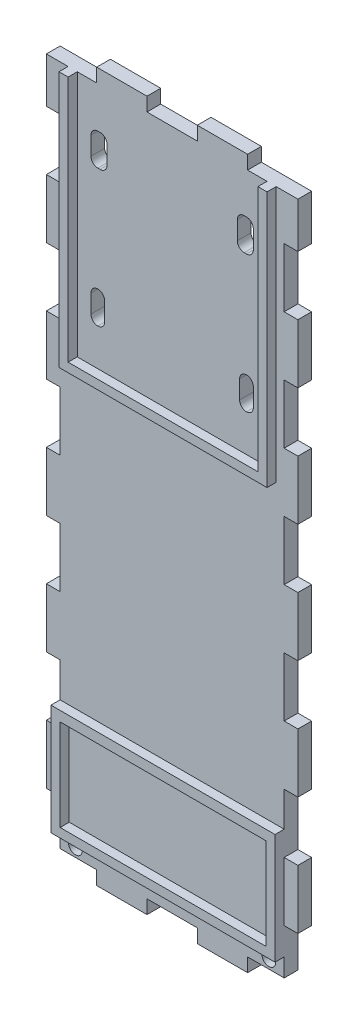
SolidWorks part; units mm, degrees
ref_plane "Front Plane" through (0, 0, 0) normal (0, 0, 1) x (1, 0, 0)
ref_plane "Top Plane" through (0, 0, 0) normal (0, 1, 0) x (1, 0, 0)
ref_plane "Right Plane" through (0, 0, 0) normal (1, 0, 0) x (0, 0, -1)
sketch "Sketch1" plane through (0, 0, 0) normal (0, 0, 1) x (1, 0, 0)
  line L1 (-27.5, 77.5) -> (27.5, 77.5)
  line L2 (-27.5, 77.5) -> (-27.5, -77.5)
  line L3 (-27.5, -77.5) -> (27.5, -77.5)
  line L4 (27.5, 77.5) -> (27.5, -77.5)
  line L5 (-27.5, 77.5) -> (27.5, -77.5) construction
  line L6 (-27.5, -77.5) -> (27.5, 77.5) construction
  point P0 (0, 0)
extrude "Boss-Extrude1" add sketch "Sketch1" along normal blind 3
sketch "Sketch2" plane through (0, 0, 3) normal (0, 0, 1) x (1, 0, 0)
  line L0 (-27.5, 77.5) -> (-27.5, 64.5833)
  line L1 (-27.5, 77.5) -> (-27.5, -77.5) construction
  line L2 (-27.5, 64.5833) -> (-24.5, 64.5833)
  line L3 (-24.5, 64.5833) -> (-24.5, 51.6667)
  line L4 (-24.5, 51.6667) -> (-27.5, 51.6667)
  line L5 (-27.5, 51.6667) -> (-27.5, 38.75)
  line L6 (-27.5, 38.75) -> (-24.5, 38.75)
  line L7 (-24.5, 38.75) -> (-24.5, 25.8333)
  line L8 (-24.5, 25.8333) -> (-27.5, 25.8333)
  line L9 (-27.5, 25.8333) -> (-27.5, 12.9167)
  line L10 (-27.5, 12.9167) -> (-24.5, 12.9167)
  line L11 (-24.5, 12.9167) -> (-24.5, 0)
  line L12 (-24.5, 0) -> (-27.5, 0)
  line L13 (-27.5, 0) -> (-27.5, -12.9167)
  line L14 (-27.5, -12.9167) -> (-24.5, -12.9167)
  line L15 (-24.5, -12.9167) -> (-24.5, -25.8333)
  line L16 (-24.5, -25.8333) -> (-27.5, -25.8333)
  line L17 (-27.5, -25.8333) -> (-27.5, -38.75)
  line L18 (-27.5, -38.75) -> (-24.5, -38.75)
  line L19 (-24.5, -38.75) -> (-24.5, -51.6667)
  line L20 (-24.5, -51.6667) -> (-27.5, -51.6667)
  line L21 (-27.5, -51.6667) -> (-27.5, -64.5833)
  line L22 (-27.5, -64.5833) -> (-24.5, -64.5833)
  line L23 (-24.5, -64.5833) -> (-24.5, -77.5)
  line L24 (-27.5, -77.5) -> (27.5, -77.5) construction
  line L25 (-27.5, 64.5833) -> (-27.5, -64.5833)
  line L26 (0, 77.5) -> (0, -77.5) construction
  line L27 (27.5, 77.5) -> (-27.5, 77.5) construction
  line L28 (24.5, -64.5833) -> (24.5, -77.5)
  line L29 (27.5, -64.5833) -> (24.5, -64.5833)
  line L30 (27.5, -51.6667) -> (27.5, -64.5833)
  line L31 (24.5, -51.6667) -> (27.5, -51.6667)
  line L32 (24.5, -38.75) -> (24.5, -51.6667)
  line L33 (27.5, -38.75) -> (24.5, -38.75)
  line L34 (27.5, -25.8333) -> (27.5, -38.75)
  line L35 (24.5, -25.8333) -> (27.5, -25.8333)
  line L36 (24.5, -12.9167) -> (24.5, -25.8333)
  line L37 (27.5, -12.9167) -> (24.5, -12.9167)
  line L38 (27.5, 0) -> (27.5, -12.9167)
  line L39 (24.5, 0) -> (27.5, 0)
  line L40 (24.5, 12.9167) -> (24.5, 0)
  line L41 (27.5, 12.9167) -> (24.5, 12.9167)
  line L42 (27.5, 25.8333) -> (27.5, 12.9167)
  line L43 (24.5, 25.8333) -> (27.5, 25.8333)
  line L44 (24.5, 38.75) -> (24.5, 25.8333)
  line L45 (27.5, 38.75) -> (24.5, 38.75)
  line L46 (27.5, 51.6667) -> (27.5, 38.75)
  line L47 (24.5, 51.6667) -> (27.5, 51.6667)
  line L48 (24.5, 64.5833) -> (24.5, 51.6667)
  line L49 (27.5, 64.5833) -> (24.5, 64.5833)
  line L50 (27.5, 77.5) -> (27.5, 64.5833)
  line L51 (-24.5, -77.5) -> (-27.5, -77.5)
  line L52 (-27.5, -77.5) -> (-27.5, 64.5833)
  line L53 (24.5, -77.5) -> (27.5, -77.5)
  line L54 (27.5, -77.5) -> (27.5, 64.5833)
extrude "Cut-Extrude1" cut sketch "Sketch2" against normal blind 3 contours L4 L3 L2 M27 | L8 L7 L6 M27 | L12 L11 L10 M27 | L16 L15 L14 M27 | L20 L19 L18 M27 | L23 L22 M27 M28 | L29 L28 M25 M28 | L33 L32 L31 M25 | L37 L36 L35 M25 | L41 L40 L39 M25 | L45 L44 L43 M25 | L49 L48 L47 M25
sketch "Sketch3" plane through (0, 0, 3) normal (0, 0, 1) x (1, 0, 0)
  line L0 (-27.5, 77.5) -> (-27.5, 74.5)
  line L1 (-27.5, 77.5) -> (-27.5, 64.5833) construction
  line L2 (-27.5, 74.5) -> (-16.5, 74.5)
  line L3 (-16.5, 74.5) -> (-16.5, 77.5)
  line L4 (27.5, 77.5) -> (-27.5, 77.5) construction
  line L5 (-16.5, 77.5) -> (-5.5, 77.5)
  line L6 (-5.5, 77.5) -> (-5.5, 74.5)
  line L7 (-5.5, 74.5) -> (5.5, 74.5)
  line L8 (5.5, 74.5) -> (5.5, 77.5)
  line L9 (5.5, 77.5) -> (16.5, 77.5)
  line L10 (16.5, 77.5) -> (16.5, 74.5)
  line L11 (16.5, 74.5) -> (27.5, 74.5)
  line L12 (27.5, 74.5) -> (27.5, 77.5)
  line L13 (-27.5, 0) -> (27.5, 0) construction
  line L14 (-27.5, 0) -> (-27.5, -12.9167) construction
  line L15 (27.5, -12.9167) -> (27.5, 0) construction
  line L16 (27.5, -74.5) -> (27.5, -77.5)
  line L17 (16.5, -74.5) -> (27.5, -74.5)
  line L18 (16.5, -77.5) -> (16.5, -74.5)
  line L19 (5.5, -77.5) -> (16.5, -77.5)
  line L20 (5.5, -74.5) -> (5.5, -77.5)
  line L21 (-5.5, -74.5) -> (5.5, -74.5)
  line L22 (-5.5, -77.5) -> (-5.5, -74.5)
  line L23 (-16.5, -77.5) -> (-5.5, -77.5)
  line L24 (-16.5, -74.5) -> (-16.5, -77.5)
  line L25 (-27.5, -74.5) -> (-16.5, -74.5)
  line L26 (-27.5, -77.5) -> (-27.5, -74.5)
  line L27 (27.5, 77.5) -> (-27.5, 77.5)
  line L28 (27.5, -77.5) -> (-27.5, -77.5)
  line L29 (-27.5, -77.5) -> (-27.4659, -77.7621)
extrude "Cut-Extrude2" cut sketch "Sketch3" against normal blind 3 contours L2 L3 M57 M58 | L10 L11 M56 M57 | L7 L8 L6 M57 | L18 L17 M33 M34 | L22 L20 L21 M33 | L25 L24 M32 M33
sketch "Sketch4" plane through (0, 0, 3) normal (0, 0, 1) x (1, 0, 0)
  line L0 (24.5, 64.5833) -> (24.5, 74.5) construction
  line L1 (16.5, 74.5) -> (27.5, 74.5) construction
  line L2 (24.5, 74.5) -> (24.5, -74.5) construction
  line L3 (24.5, -74.5) -> (-24.5, -74.5) construction
  line L4 (-24.5, -74.5) -> (-24.5, 74.5) construction
  line L5 (-27.5, 74.5) -> (-16.5, 74.5) construction
  line L6 (-24.5, 74.5) -> (24.5, 74.5) construction
  line L7 (24.5, 74.5) -> (20.75, 74.5)
  line L8 (22.75, 47.5) -> (20.75, 47.5) construction
  line L9 (-20.75, 74.5) -> (20.75, 74.5)
  line L10 (-20.75, 74.5) -> (-20.75, 20.5)
  line L11 (-20.75, 20.5) -> (20.75, 20.5)
  line L12 (20.75, 74.5) -> (20.75, 20.5)
  line L13 (-20.75, 74.5) -> (20.75, 20.5) construction
  line L14 (-20.75, 20.5) -> (20.75, 74.5) construction
  line L15 (-20.75, 74.5) -> (-22.75, 74.5)
  line L16 (-22.75, 74.5) -> (-22.75, 18.5)
  line L17 (-22.75, 18.5) -> (22.75, 18.5)
  line L18 (22.75, 74.5) -> (22.75, 18.5)
  line L21 (0, 19.5) -> (0, 18.5) construction
  point P14 (0, 47.5)
  point P15 (0, 47.5)
  dimension "D2" = 54
  dimension "D3" = 41.5
  dimension "D4" = 2
  dimension "D5" = 1
extrude "Boss-Extrude2" add sketch "Sketch4" along normal blind 2 contours L18 L7 L12 L11 L10 L15 L16 L17
sketch "Sketch5" plane through (0, 0, 3) normal (0, 0, 1) x (1, 0, 0)
  line L0 (-24.5, 18.5) -> (-24.5, -74.5) construction
  line L1 (-24.5, -74.5) -> (24.5, -74.5) construction
  line L2 (24.5, -74.5) -> (24.5, 18.5) construction
  line L3 (-24.5, -46.323) -> (24.5, -46.323)
  line L4 (-24.5, -74.5) -> (-24.5, 18.5) construction
  line L5 (24.5, -46.323) -> (24.5, -48.5)
  line L6 (-24.5, -48.5) -> (-24.5, -46.323)
  line L9 (-24.5, -48.5) -> (24.5, -48.5)
  line L20 (-22.5, 18.5) -> (-24.5, 18.5) construction
  point P3 (0, -15)
  point P14 (0, -15)
extrude "Boss-Extrude3" add sketch "Sketch5" along normal blind 2
sketch "Sketch6" plane through (0, 0, 3) normal (0, 0, 1) x (1, 0, 0)
  line L0 (-24.5, -74.5) -> (-24.5, -48.5) construction
  line L1 (-24.5, -48.5) -> (24.5, -48.5) construction
  line L2 (24.5, -48.5) -> (24.5, -74.5) construction
  line L3 (24.5, -74.5) -> (-24.5, -74.5) construction
  line L4 (-22.5, -48.5) -> (-24.5, -48.5)
  line L5 (22.5, -48.5) -> (24.5, -48.5)
  line L7 (-22.5, -48.5) -> (-22.5, -68.5)
  line L8 (-22.5, -68.5) -> (22.5, -68.5)
  line L9 (22.5, -48.5) -> (22.5, -68.5)
  line L13 (-24.5, -48.5) -> (-24.5, -70.5)
  line L14 (-24.5, -70.5) -> (24.5, -70.5)
  line L15 (24.5, -48.5) -> (24.5, -70.5)
  point P4 (0, -58.5)
  point P9 (0, -58.5)
  point P11 (0, -58.5)
  point P15 (0, -58.5)
  point P18 (0, -70.5)
  point P22 (0, -68.5)
  dimension "D1" = 45
  dimension "D2" = 20
  dimension "D3" = 2
sketch "Sketch7" plane through (0, 0, 3) normal (0, 0, 1) x (1, 0, 0)
  line L3 (-17.7507, 58.5) -> (-17.7507, 35.6) construction
  line L4 (-17.7507, 65.5) -> (-14.2507, 65.5)
  line L5 (-17.7507, 65.5) -> (-17.7507, 58.5)
  line L6 (-17.7507, 58.5) -> (-14.2507, 58.5)
  line L7 (-14.2507, 65.5) -> (-14.2507, 58.5)
  line L8 (-20.75, 20.5) -> (20.75, 20.5) construction
  line L9 (-17.7507, 35.6) -> (-14.7507, 35.6)
  line L10 (-17.7507, 35.6) -> (-17.7507, 28.6)
  line L12 (-17.7507, 28.6) -> (-14.7507, 28.6)
  line L13 (-14.7507, 35.6) -> (-14.7507, 28.6)
  line L14 (0, 74.5) -> (0, 20.5)
  line L15 (-5.5, 74.5) -> (5.5, 74.5) construction
  line L16 (17.7507, 28.6) -> (14.7507, 28.6)
  line L17 (17.7507, 35.6) -> (14.7507, 35.6)
  line L18 (17.7507, 35.6) -> (17.7507, 28.6)
  line L19 (14.7507, 35.6) -> (14.7507, 28.6)
  line L20 (17.7507, 58.5) -> (14.2507, 58.5)
  line L21 (17.7507, 65.5) -> (17.7507, 58.5)
  line L22 (14.2507, 65.5) -> (14.2507, 58.5)
  line L23 (17.7507, 65.5) -> (14.2507, 65.5)
  dimension "D3" = 7
  dimension "D4" = 3.5
  dimension "D5" = 22.9
  dimension "D6" = 3
  dimension "D7" = 7
extrude "Cut-Extrude3" cut sketch "Sketch7" against normal blind 41 contours L7 L4 L5 L6 | L21 L23 L22 L20 | L10 L12 L13 L9 | L19 L16 L18 L17
fillet "Fillet1" radius 1.5 16 edges at (-17.7507, 65.5, 1.5) (-14.2507, 58.5, 1.5) (-14.2507, 65.5, 1.5) (-17.7507, 58.5, 1.5) (-17.7507, 28.6, 1.5) (-14.7507, 35.6, 1.5) (-17.7507, 35.6, 1.5) (-14.7507, 28.6, 1.5) (14.7507, 28.6, 1.5) (17.7507, 28.6, 1.5) (17.7507, 35.6, 1.5) (14.7507, 35.6, 1.5) (14.2507, 58.5, 1.5) (17.7507, 58.5, 1.5) (14.2507, 65.5, 1.5) (17.7507, 65.5, 1.5)
extrude "Boss-Extrude4" add sketch "Sketch6" along normal blind 2
sketch "Sketch8" plane through (0, 0, 3) normal (0, 0, 1) x (1, 0, 0)
  line L0 (-21.1474, -70.5) -> (-21.1474, -74.5) construction
  line L1 (-24.5, -70.5) -> (24.5, -70.5) construction
  line L2 (-24.5, -74.5) -> (-16.5, -74.5) construction
  line L3 (0, -70.5) -> (0, -74.5) construction
  line L4 (-5.5, -74.5) -> (5.5, -74.5) construction
  circle A0 centre (-21.1474, -72.5) radius 1.5
  circle A1 centre (21.1474, -72.5) radius 1.5
  dimension "D1" = 3
extrude "Cut-Extrude4" cut sketch "Sketch8" against normal blind 3
equation "\"Thickness of material\"= 3mm"
equation "\"Length of box\"= 155mm"
equation "\"width of box\"= 55mm"
equation "\"D2@Sketch1\"=\"Length of box\""
equation "\"D1@Boss-Extrude1\"=\"Thickness of material\""
equation "\"D1@Sketch2\"=\"Length of box\"/12"
equation "\"D2@Sketch2\"=\"Length of box\"/12"
equation "\"D4@Sketch2\"=\"Length of box\"/12"
equation "\"D5@Sketch2\"=\"Length of box\"/12"
equation "\"D6@Sketch2\"=\"Length of box\"/12"
equation "\"D7@Sketch2\"=\"Length of box\"/12"
equation "\"D8@Sketch2\"=\"Length of box\"/12"
equation "\"D9@Sketch2\"=\"Length of box\"/12"
equation "\"D10@Sketch2\"=\"Length of box\"/12"
equation "\"D11@Sketch2\"=\"Length of box\"/12"
equation "\"D12@Sketch2\"=\"Thickness of material\""
equation "\"D13@Sketch2\"=\"Thickness of material\""
equation "\"D14@Sketch2\"=\"Thickness of material\""
equation "\"D15@Sketch2\"=\"Thickness of material\""
equation "\"D16@Sketch2\"=\"Thickness of material\""
equation "\"D17@Sketch2\"=\"Thickness of material\""
equation "\"D1@Sketch1\"=\"width of box\""
equation "\"D5@Sketch3\"=\"width of box\"/5"
equation "\"D3@Sketch3\"=\"width of box\"/5"
equation "\"D4@Sketch3\"=\"Thickness of material\""
equation "\"D6@Sketch3\"=\"Thickness of material\""
equation "\"D1@Sketch3\"=\"Thickness of material\""
equation "\"D2@Sketch3\"=\"width of box\"/5"
equation "\"D7@Sketch3\"=\"width of box\"/5"
equation "\"D1@Cut-Extrude2\"=\"Thickness of material\""
equation "\"D3@Sketch2\"=\"Length of box\"/12"
